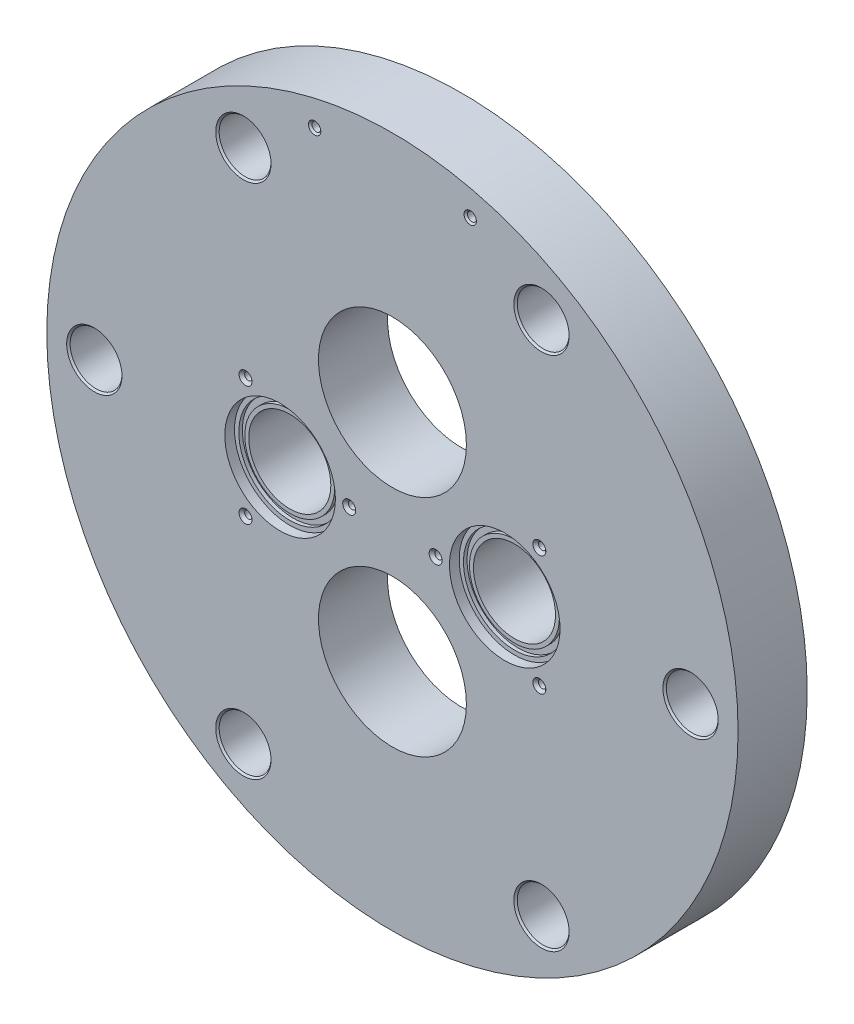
SolidWorks part; units mm, degrees
other "Markup1"
sketch "Sketch16" plane through (127, 127, 25.4) normal (0.4, 0.515, 0.7581) x (0.8844, 0, -0.4667)
ref_plane "Front" through (0, 0, 0) normal (0, 0, 1) x (1, 0, 0)
ref_plane "Top" through (0, 0, 0) normal (0, 1, 0) x (1, 0, 0)
ref_plane "Right" through (0, 0, 0) normal (1, 0, 0) x (0, 0, -1)
sketch "Sketch1" plane through (0, 0, 0) normal (0, 0, 1) x (1, 0, 0)
  circle A0 centre (0, 0) radius 127
  dimension "D1" = 254
extrude "Dia=10\" X 1\" Thick Extrusion" add sketch "Sketch1" along normal blind 25.4
hole_wizard "Adjustable Mounting Holes (0.500\")" positions "Sketch2" profile "Sketch3" hole size "3/4" standard "ANSI Inch"
sketch "Sketch2" plane through (0, 0, 25.4) normal (0, 0, 1) x (1, 0, 0)
  point P0 (-109.5375, 0)
  point P13 (-54.7687, 94.8623)
  point P14 (54.7688, 94.8623)
  point P15 (109.5375, 0)
  point P16 (54.7687, -94.8623)
  point P17 (-54.7688, -94.8623)
  dimension "D1" = 109.5375
  dimension "D2" = 6
sketch "Sketch3" plane through (-109.5375, 0, 25.4) normal (1, 0, 0) x (0, -1, 0)
  line L0 (0, 0) -> (0, 25.4)
  line L1 (0, 25.4) -> (9.525, 25.4)
  line L2 (9.525, 25.4) -> (9.525, 0.635)
  line L3 (9.525, 0.635) -> (10.16, 0)
  line L5 (10.16, 0) -> (0, 0)
  line L6 (-9.525, 0.635) -> (-10.16, 0) construction
  line L11 (0, -6.35) -> (0, 107.95) construction
  dimension "Thru Hole Dia." = 19.05
  dimension "Thru Hole Depth" = 25.4
  dimension "Near C'Sink Dia." = 20.32
  dimension "Near C'Sink Angle" = 90
sketch "Sketch4" plane through (0, 0, 25.4) normal (0, 0, 1) x (1, 0, 0)
  circle A0 centre (0, 41.275) radius 27.178
  circle A1 centre (0, -41.275) radius 27.178
  dimension "D1" = 54.356
  dimension "D2" = 82.55
  dimension "D3" = 41.275
extrude "Steller Tube Thru Holes" cut sketch "Sketch4" against normal through all
sketch "Sketch6" plane through (0, 0, 25.4) normal (0, 0, 1) x (1, 0, 0)
  circle A0 centre (41.275, 0) radius 15.0812
  circle A1 centre (-41.275, 0) radius 15.0812
  dimension "D1" = 30.1625
  dimension "D2" = 82.55
  dimension "D3" = 41.275
extrude "Metrology Beam Thru Hole (1.1875 in)" cut sketch "Sketch6" against normal through all both and the other way through all
sketch "Sketch7" plane through (0, 0, 25.4) normal (0, 0, 1) x (1, 0, 0)
  circle A0 centre (-41.275, 0) radius 20.32
  circle A1 centre (41.275, 0) radius 20.32
  dimension "D1" = 40.64
extrude "Metrology Window Recess" cut sketch "Sketch7" against normal blind 3.556
sketch "Sketch8" plane through (0, 0, 21.844) normal (0, 0, 1) x (1, 0, 0)
  circle A0 centre (-41.275, 0) radius 13.2842
  circle A1 centre (-41.275, 0) radius 17.3736
  circle A2 centre (41.275, 0) radius 13.2842
  circle A3 centre (41.275, 0) radius 17.3736
  dimension "D1" = 26.5684
  dimension "D2" = 4.0894
extrude "O-Ring #215 Gland" [suppressed] cut sketch "Sketch8" against normal blind 2.6416
hole_wizard "Left Metrology Window Screws #6-32" positions "Sketch9" profile "Sketch10" tap size "#6-32" standard "ANSI Inch"
sketch "Sketch9" plane through (0, 0, 25.4) normal (0, 0, 1) x (1, 0, 0)
  circle A0 centre (-41.275, 0) radius 25.4 construction
  point P0 (-15.875, 0)
  point P16 (-53.975, -21.997)
  point P17 (-53.975, 21.997)
  dimension "D1" = 50.8
  dimension "D3" = 41.275
  dimension "D2" = 3
sketch "Sketch10" plane through (-15.875, 0, 25.4) normal (1, 0, 0) x (0, -1, 0)
  line L0 (0, 0) -> (0, 11.176)
  line L1 (0, 11.176) -> (1.3525, 10.3633)
  line L2 (1.3525, 10.3633) -> (1.3525, 1.0351)
  line L3 (1.3525, 1.0351) -> (2.3876, 0)
  line L5 (2.3876, 0) -> (0, 0)
  line L6 (-1.3525, 1.0351) -> (-2.3876, 0) construction
  line L10 (0, 11.176) -> (-1.3526, 10.3633) construction
  line L11 (0, -6.35) -> (0, 107.95) construction
  dimension "Tap Drill Dia." = 2.7051
  dimension "Tap Drill Depth" = 11.176
  dimension "Near C'Sink Dia." = 4.7752
  dimension "Near C'Sink Angle" = 90
  dimension "Drill Angle" = 118
hole_wizard "Right Metrology Window Screws #6-32" positions "Sketch11" profile "Sketch12" tap size "#6-32" standard "ANSI Inch"
sketch "Sketch11" plane through (0, 0, 25.4) normal (0, 0, 1) x (1, 0, 0)
  circle A0 centre (41.275, 0) radius 25.4
  point P0 (15.875, 0)
  point P14 (53.975, 21.997)
  point P15 (53.975, -21.997)
  dimension "D1" = 50.8
  dimension "D2" = 3
sketch "Sketch12" plane through (15.875, 0, 25.4) normal (1, 0, 0) x (0, -1, 0)
  line L0 (0, 0) -> (0, 11.176)
  line L1 (0, 11.176) -> (1.3525, 10.3633)
  line L2 (1.3525, 10.3633) -> (1.3525, 1.0351)
  line L3 (1.3525, 1.0351) -> (2.3876, 0)
  line L5 (2.3876, 0) -> (0, 0)
  line L6 (-1.3525, 1.0351) -> (-2.3876, 0) construction
  line L10 (0, 11.176) -> (-1.3526, 10.3633) construction
  line L11 (0, -6.35) -> (0, 107.95) construction
  dimension "Tap Drill Dia." = 2.7051
  dimension "Tap Drill Depth" = 11.176
  dimension "Near C'Sink Dia." = 4.7752
  dimension "Near C'Sink Angle" = 90
  dimension "Drill Angle" = 118
sketch "Sketch13" plane through (0, 0, 0) normal (0, 0, -1) x (-1, 0, 0)
  circle A0 centre (0, 0) radius 95.0468
  circle A1 centre (0, 0) radius 99.1362
  dimension "D1" = 190.0936
  dimension "D2" = 4.0894
extrude "O-Ring #2-264 Gland" cut sketch "Sketch13" against normal blind 2.6416
hole_wizard "#8-32 Tapped Hole1" positions "Sketch14" profile "Sketch15" tap size "#8-32" standard "ANSI Inch"
sketch "Sketch14" plane through (0, 0, 0) normal (0, 0, -1) x (-1, 0, 0)
  line L0 (0, 0) -> (0, 134.0011) construction
  line L2 (0, 0) -> (-151.8621, 0) construction
  line L4 (0, 41.275) -> (-100.8864, 41.275) construction
  point P0 (-34.925, 41.275)
  point P42 (-17.4625, 71.5209)
  point P43 (17.4625, 71.5209)
  point P44 (34.925, 41.275)
  point P45 (17.4625, 11.0291)
  point P46 (-17.4625, 11.0291)
  point P48 (-17.4625, -11.0291)
  point P49 (17.4625, -11.0291)
  point P50 (34.925, -41.275)
  point P51 (17.4625, -71.5209)
  point P52 (-17.4625, -71.5209)
  point P53 (-34.925, -41.275)
  dimension "D1" = 41.275
  dimension "D2" = 34.925
  dimension "D3" = 6
sketch "Sketch15" plane through (34.925, 41.275, 0) normal (1, 0, 0) x (0, 1, 0)
  line L0 (0, 0) -> (0, 15.0876)
  line L1 (0, 15.0876) -> (1.7272, 14.0498)
  line L2 (1.7272, 14.0498) -> (1.7272, 0.9906)
  line L3 (1.7272, 0.9906) -> (2.7178, 0)
  line L5 (2.7178, 0) -> (0, 0)
  line L6 (-1.7272, 0.9906) -> (-2.7178, 0) construction
  line L10 (0, 15.0876) -> (-1.7272, 14.0498) construction
  line L11 (0, -6.35) -> (0, 107.95) construction
  dimension "Tap Drill Dia." = 3.4544
  dimension "Tap Drill Depth" = 15.0876
  dimension "Near C'Sink Dia." = 5.4356
  dimension "Near C'Sink Angle" = 90
  dimension "Drill Angle" = 118
sketch "Sketch17" plane through (0, 0, 21.844) normal (0, 0, 1) x (1, 0, 0)
  circle A0 centre (-41.275, 0) radius 18.7325
  circle A1 centre (-41.275, 0) radius 16.5227
  circle A2 centre (41.275, 0) radius 18.7325
  circle A3 centre (41.275, 0) radius 16.5227
  dimension "D1" = 33.0454
  dimension "D2" = 2.2098
extrude "O-Ring 2-027 Gland" cut sketch "Sketch17" against normal blind 1.3208
hole_wizard "#30 (0.1285) Diameter Hole1" positions "Sketch19" profile "Sketch21" hole size "#30" standard "ANSI Inch"
sketch "Sketch19" plane through (0, 0, 25.4) normal (0, 0, 1) x (1, 0, 0)
  point P0 (-28.575, 114.3)
  point P2 (28.575, 114.3)
  dimension "D1" = 57.15
  dimension "D2" = 28.575
  dimension "D3" = 114.3
sketch "Sketch21" plane through (-28.575, 114.3, 25.4) normal (1, 0, 0) x (0, -1, 0)
  line L0 (0, 0) -> (0, 25.4)
  line L1 (0, 25.4) -> (1.6319, 25.4)
  line L2 (1.6319, 25.4) -> (1.6319, 0.635)
  line L3 (1.6319, 0.635) -> (2.2669, 0)
  line L5 (2.2669, 0) -> (0, 0)
  line L6 (-1.6319, 0.635) -> (-2.2669, 0) construction
  line L11 (0, -6.35) -> (0, 107.95) construction
  dimension "Thru Hole Dia." = 3.2639
  dimension "Thru Hole Depth" = 25.4
  dimension "Near C'Sink Dia." = 4.5339
  dimension "Near C'Sink Angle" = 90
